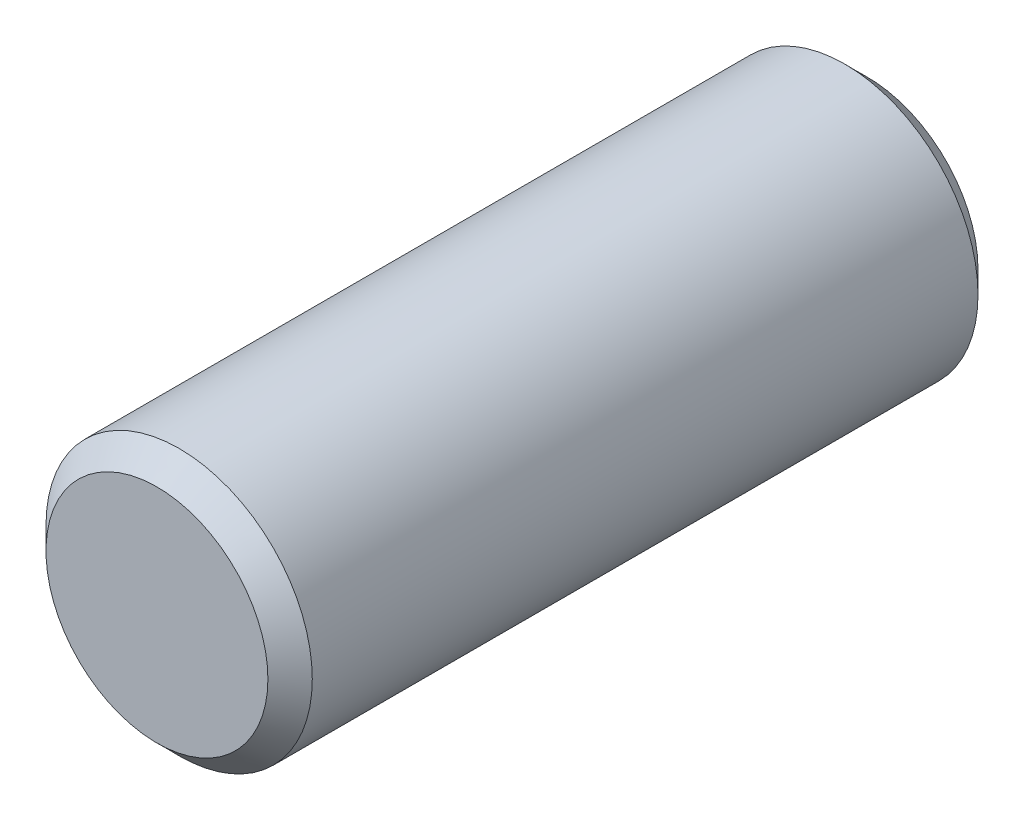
SolidWorks part; units mm, degrees
ref_plane "Plan de face" through (0, 0, 0) normal (0, 0, 1) x (1, 0, 0)
ref_plane "Plan de dessus" through (0, 0, 0) normal (0, 1, 0) x (1, 0, 0)
ref_plane "Plan de droite" through (0, 0, 0) normal (1, 0, 0) x (0, 0, -1)
sketch "Esquisse1" plane through (0, 0, 0) normal (0, 0, 1) x (1, 0, 0)
  circle A0 centre (0, 0) radius 3
  dimension "D1" = 6
extrude "Extrusion1" add sketch "Esquisse1" along normal blind 16
sketch "Esquisse2" plane through (0, 0, 0) normal (0, 0, -1) x (-1, 0, 0)
  line L1 (0.4462, -1.6736) -> (1.6725, -0.4504)
  line L2 (1.6725, -0.4504) -> (1.2263, 1.2232)
  line L3 (1.2263, 1.2232) -> (-0.4462, 1.6736)
  line L4 (-0.4462, 1.6736) -> (-1.6725, 0.4504)
  line L5 (-1.6725, 0.4504) -> (-1.2263, -1.2232)
  line L6 (-1.2263, -1.2232) -> (0.4462, -1.6736)
  circle A0 centre (0, 0) radius 1.5 construction
  dimension "D1" = 3
extrude "Enlèv. mat.-Extru.1" cut sketch "Esquisse2" against normal blind 4
chamfer "Chanfrein1" distance 0.5 angle 45 2 edges at (3, 0, 16) (3, 0, 0)
